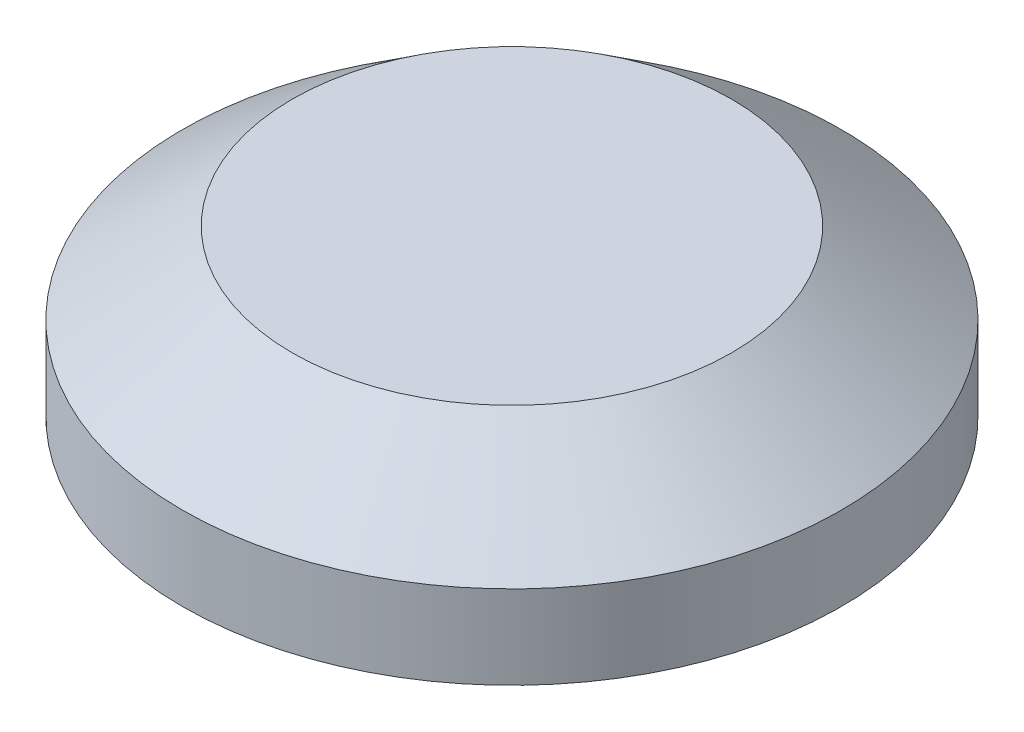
SolidWorks part; units mm, degrees
ref_plane "Ebene vorne" through (0, 0, 0) normal (0, 0, 1) x (1, 0, 0)
ref_plane "Ebene oben" through (0, 0, 0) normal (0, 1, 0) x (1, 0, 0)
ref_plane "Ebene rechts" through (0, 0, 0) normal (1, 0, 0) x (0, 0, -1)
sketch "Skizze1" plane through (0, 0, 0) normal (0, 0, 1) x (1, 0, 0)
  line L0 (0, 66.7244) -> (0, -53.8987) construction
  line L1 (-6, 0) -> (0, 0)
  line L2 (-6, 1.5203) -> (-6, 0)
  line L3 (-6, 1.5203) -> (-4, 3)
  line L4 (-4, 3) -> (0, 3)
  line L5 (0, 0) -> (0, 3)
  dimension "D1" = 12
  dimension "D2" = 8
  dimension "D3" = 3
revolve "Rotation1" add sketch "Skizze1" angle 360 about L0
